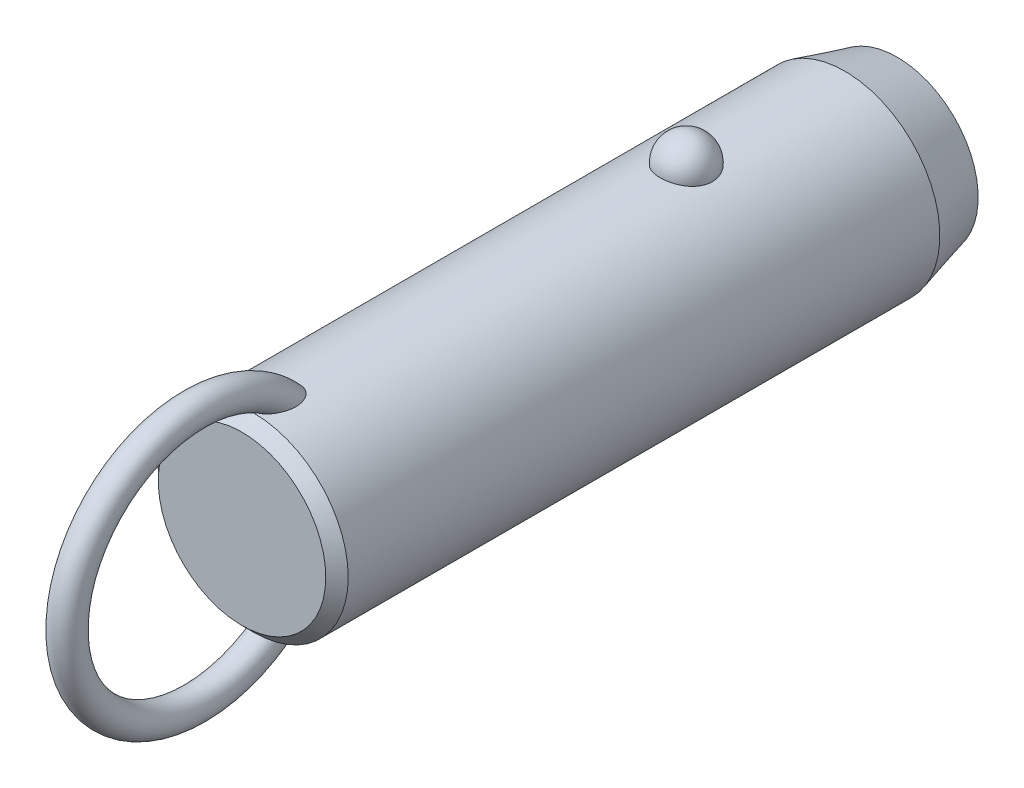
SolidWorks part; units mm, degrees
ref_plane "Front Plane" through (0, 0, 0) normal (0, 0, 1) x (1, 0, 0)
ref_plane "Top Plane" through (0, 0, 0) normal (0, 1, 0) x (1, 0, 0)
ref_plane "Right Plane" through (0, 0, 0) normal (1, 0, 0) x (0, 0, -1)
sketch "Sketch2" plane through (0, 0, 0) normal (0, 0, 1) x (1, 0, 0)
  circle A0 centre (0, 0) radius 12.7
  point P3 (0, 12.7)
  dimension "D1" = 25.4
extrude "Boss-Extrude1" add sketch "Sketch2" along normal blind 43.2
sketch "Sketch3" plane through (0, 0, 0) normal (0, 0, -1) x (-1, 0, 0)
  circle A0 centre (0, 0) radius 12.7
  dimension "D1" = 25.4
extrude "Boss-Extrude2" add sketch "Sketch3" along normal blind 31.7
chamfer "Chamfer1" distance 7 angle 15 1 edges at (-12.7, 0, -31.7)
sketch "Sketch12" plane through (0, 0, 0) normal (1, 0, 0) x (0, 0, -1)
  line L0 (-43.2, 12.7) -> (-43.2, -12.7) construction
  point P0 (-43.2, 0)
sketch "Sketch13" plane through (0, 0, 0) normal (1, 0, 0) x (0, 0, -1)
  circle A0 centre (-62.25, 0) radius 19.05
  point P2 (-43.2, 0)
  dimension "D1" = 38.1
sketch "Sketch14" plane through (0, 0, 0) normal (0, 1, 0) x (1, 0, 0)
  circle A0 centre (0, -45.2) radius 2
  point P2 (0, -43.2)
  dimension "D1" = 4
sweep "Sweep1" add profiles "Sketch14" path "Sketch13"
sketch "Sketch15" plane through (0, 0, 43.2) normal (0, 0, 1) x (1, 0, 0)
  circle A0 centre (0, 0) radius 12.7
  dimension "D1" = 25.4
extrude "Boss-Extrude3" add sketch "Sketch15" along normal blind 12.7
chamfer "Chamfer2" distance 1.5 angle 45 1 edges at (12.7, 0, 55.9)
sketch "Sketch18" plane through (0, 0, 0) normal (1, 0, 0) x (0, 0, -1)
  line L0 (24.7, 12.7) -> (-48.051, 12.7) construction
  line L1 (3.5, 16.2) -> (3.5, 9.2)
  line L2 (-48.051, -12.7) -> (24.7, -12.7) construction
  arc A0 (3.5, 16.2) -> (3.5, 9.2) centre (3.5, 12.7) ccw
  point P4 (0, 12.7)
  dimension "D1" = 28.9
revolve "Revolve1" add sketch "Sketch18" angle 360 about L1
